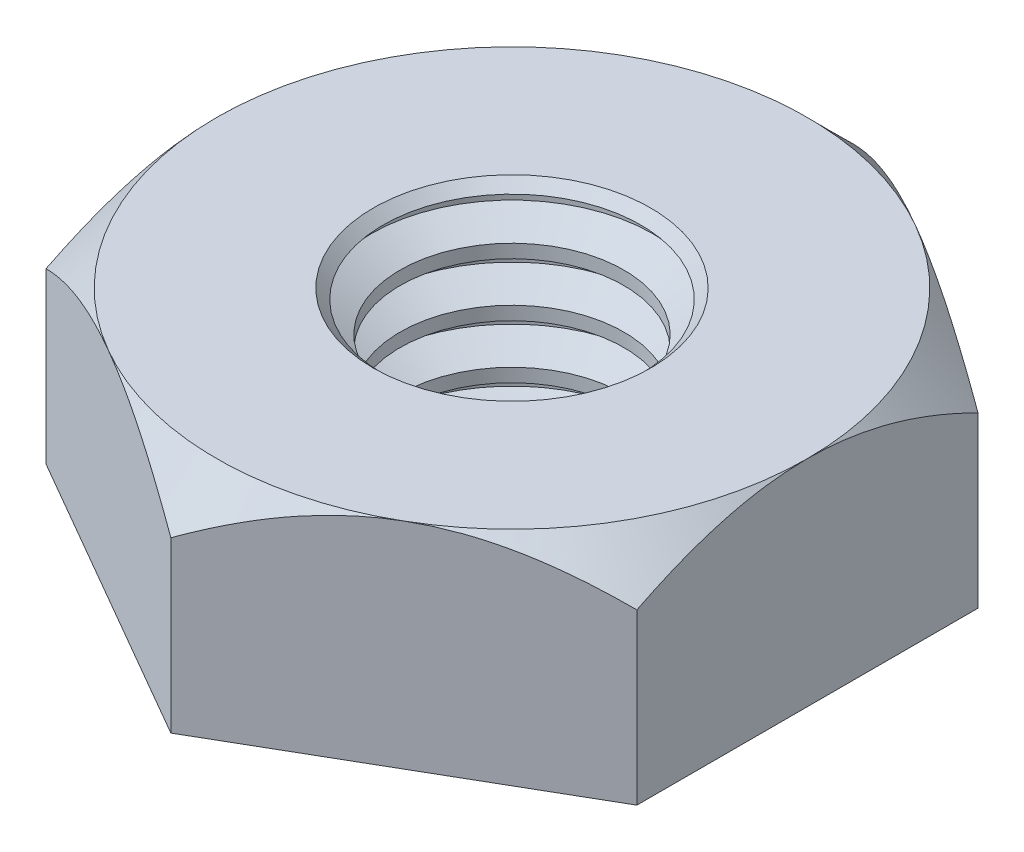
SolidWorks part; units mm, degrees
ref_plane "Front" through (0, 0, 0) normal (0, 0, 1) x (1, 0, 0)
ref_plane "Top" through (0, 0, 0) normal (0, 1, 0) x (1, 0, 0)
ref_plane "Right" through (0, 0, 0) normal (1, 0, 0) x (0, 0, -1)
sketch "Sketch1" plane through (0, 0, 0) normal (0, 1, 0) x (1, 0, 0)
  line L1 (0, 5.041) -> (-4.3656, 2.5205)
  line L2 (-4.3656, 2.5205) -> (-4.3656, -2.5205)
  line L3 (-4.3656, -2.5205) -> (0, -5.041)
  line L4 (0, -5.041) -> (4.3656, -2.5205)
  line L5 (4.3656, -2.5205) -> (4.3656, 2.5205)
  line L6 (4.3656, 2.5205) -> (0, 5.041)
  circle A0 centre (0, 0) radius 4.3656 construction
  dimension "Hex Flats" = 8.7312
extrude "Extrude1" add sketch "Sketch1" along normal blind 3.175
sketch "Sketch3" plane through (0, 0, 0) normal (1, 0, 0) x (0, 0, -1)
  line L0 (4.3656, 3.175) -> (5.041, 2.4996)
  line L1 (2.5205, 3.175) -> (5.041, 3.175) construction
  line L2 (5.041, 3.175) -> (5.041, 0) construction
  line L3 (5.041, 2.4996) -> (5.041, 3.175)
  line L4 (5.041, 3.175) -> (4.3656, 3.175)
  line L5 (0, 0.542) -> (0, -0.542) construction
  dimension "D1" = 45
  dimension "D2" = 8.7312
revolve "Cut-Revolve2" cut sketch "Sketch3" angle 360 about L5
sketch "Sketch2" plane through (0, 0, 0) normal (0, 0, 1) x (1, 0, 0)
  line L0 (0, 1.6636) -> (0, -0.3796) construction
  line L1 (0, 3.175) -> (1.6532, 3.175)
  line L3 (0, 3.175) -> (4.3656, 3.175) construction
  line L4 (0, 2.3812) -> (1.6532, 2.3812)
  line L5 (1.6532, 3.175) -> (2.0828, 2.927)
  line L6 (2.0828, 2.927) -> (2.0828, 2.8277)
  line L7 (2.0828, 2.8277) -> (1.6532, 2.5797)
  line L9 (1.6532, 2.3812) -> (1.6532, 2.5797)
  line L10 (0, 2.3812) -> (0, 3.175)
  line L11 (1.6532, 3.175) -> (1.6532, 2.5797) construction
  line L12 (2.0828, 2.8773) -> (1.6532, 2.8773) construction
  dimension "D1" = 60
  dimension "D2" = 0.1984
  dimension "D5" = 0.0992
  dimension "Pitch" = 0.7937
  dimension "Major Dia." = 4.1656
revolve "Cut-Revolve1" cut sketch "Sketch2" angle 360 about L0
pattern_linear "LPattern2" count 5 spacing 0.7937 along (0, -1, 0)
chamfer "Chamfer1" distance 0.3969 angle 45
equation "\"D5@Sketch2\"=\"Pitch@Sketch2\"/8"
equation "\"D2@Sketch2\"=\"Pitch@Sketch2\"/4"
equation "\"D3@LPattern2\"=\"Pitch@Sketch2\""
equation "\"D1@LPattern2\"=\"Height@Extrude1\"/\"Pitch@Sketch2\"+.5"
equation "\"D2@Sketch3\"=\"Hex Flats@Sketch1\""
equation "\"D1@Chamfer1\"=\"Pitch@Sketch2\"/2"
